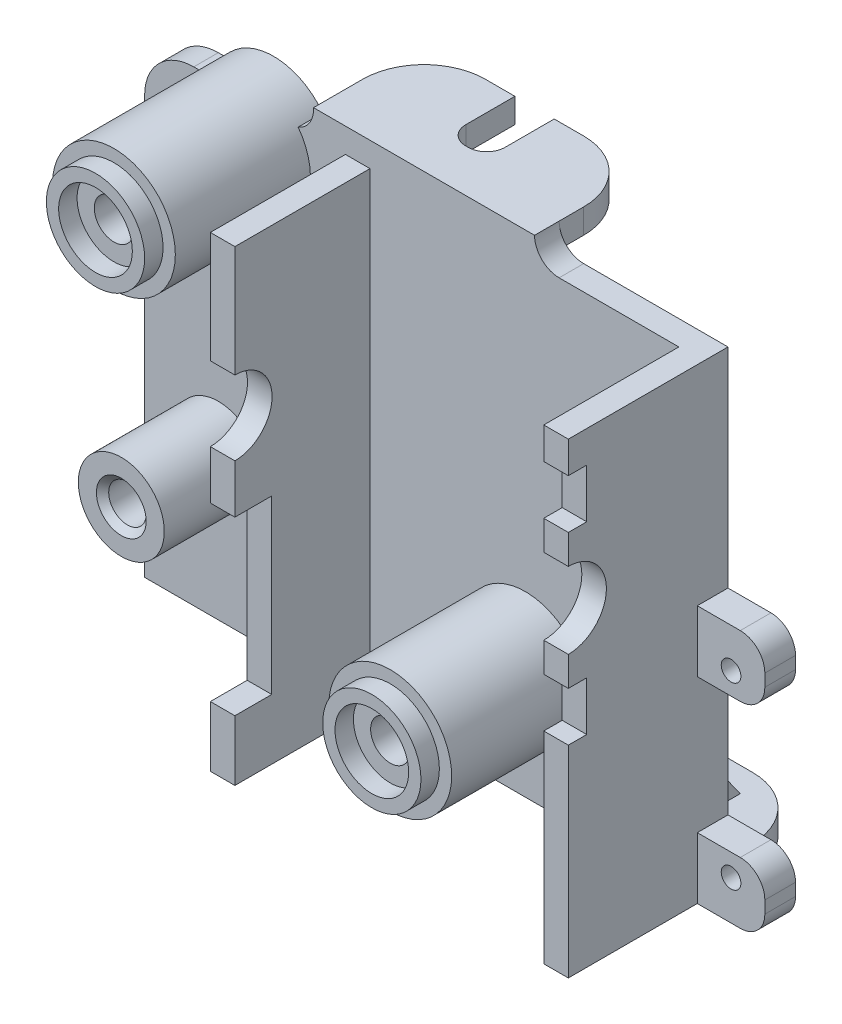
SolidWorks part; units mm, degrees
ref_plane "Face" through (0, 0, 0) normal (0, 0, 1) x (1, 0, 0)
ref_plane "Dessus" through (0, 0, 0) normal (0, 1, 0) x (1, 0, 0)
ref_plane "Droite" through (0, 0, 0) normal (1, 0, 0) x (0, 0, -1)
sketch "Esquisse1" plane through (0, 0, 0) normal (0, 0, 1) x (1, 0, 0)
  line L0 (-18.636, 0) -> (40.6725, 0) construction
  line L1 (0, 13.4516) -> (0, -31.9474) construction
  line L2 (-13.58, -13.58) -> (12.9107, -13.58) construction
  line L3 (11, 10.3689) -> (11, -7.2863) construction
  line L4 (12.35, 12.5556) -> (12.35, -11.4741) construction
  line L5 (37.5, 12.5556) -> (37.5, -10.7539) construction
  line L6 (-16.5535, -25.5) -> (42.4584, -25.5) construction
  line L7 (-16.0297, -27.5) -> (41.191, -27.5) construction
  line L8 (-6, 14.3889) -> (-6, -30.5277) construction
  line L9 (12.35, 10.45) -> (38.7737, 10.45) construction
  line L10 (11.7976, -10.45) -> (39.5594, -10.45) construction
  line L11 (39.5, 11.377) -> (39.5, -30.9205) construction
  line L12 (-10.1369, 12.5) -> (39.5, 12.5) construction
  line L14 (-6, 12.5) -> (39.5, 12.5)
  line L15 (-6, 12.5) -> (-6, -25.5)
  line L16 (-6, -25.5) -> (39.5, -25.5)
  line L17 (39.5, 12.5) -> (39.5, -25.5)
  circle A0 centre (0, -13.58) radius 11.5 construction
  circle A1 centre (0, -13.58) radius 1.5
extrude "Base-Extrusion" add sketch "Esquisse1" along normal mid plane 26
sketch "Esquisse5" plane through (0, 12.5, 0) normal (0, 1, 0) x (-1, 0, 0)
  line L0 (-12.35, -16.3279) -> (-12.35, 15.7701) construction
  line L1 (-10.35, -15.9222) -> (-10.35, 14.6545) construction
  line L2 (-37.5, -14.3503) -> (-37.5, 16.7842) construction
  line L3 (-39.5, -13.7925) -> (-39.5, 16.3786) construction
  line L4 (-40.8108, 11) -> (9.1448, 11) construction
  line L5 (-41.2165, -11) -> (8.3249, -11) construction
  line L7 (-37.5, 11) -> (-12.35, 11)
  line L8 (-37.5, 11) -> (-37.5, -11)
  line L9 (-37.5, -11) -> (-12.35, -11)
  line L10 (-12.35, 11) -> (-12.35, -11)
  line L11 (-10.35, 11) -> (8.7031, 11)
  line L12 (-10.35, 11) -> (-10.35, -11)
  line L13 (-10.35, -11) -> (8.7031, -11)
  line L14 (8.7031, 11) -> (8.7031, -11)
extrude "Enlèv. mat.-Extru.6" cut sketch "Esquisse5" against normal blind 40
sketch "Esquisse3" plane through (0, 0, 13) normal (0, 0, 1) x (1, 0, 0)
  circle A0 centre (0, -13.58) radius 3.5
extrude "Boss.-Extru.1" add sketch "Esquisse3" against normal blind 25
sketch "Esquisse4" plane through (0, 0, 13) normal (0, 0, 1) x (1, 0, 0)
  circle A0 centre (0, -13.58) radius 1.525
extrude "Enlèv. mat.-Extru.2" cut sketch "Esquisse4" against normal through all
sketch "Esquisse6" plane through (39.5, 0, 0) normal (1, 0, 0) x (0, 0, -1)
  line L0 (-13.8762, 0) -> (18.6073, 0) construction
  line L1 (0, 14.021) -> (0, -22.5589) construction
  circle A0 centre (0, 0.42) radius 3.025
extrude "Enlèv. mat.-Extru.3" cut sketch "Esquisse6" against normal through all
sketch "Esquisse7" plane through (39.5, 0, 0) normal (1, 0, 0) x (0, 0, -1)
  circle A0 centre (0, 0.42) radius 3.1
extrude "Enlèv. mat.-Extru.4" cut sketch "Esquisse7" against normal blind 3
sketch "Esquisse8" plane through (0, -25.5, 0) normal (0, -1, 0) x (1, 0, 0)
  line L0 (-6, 21.1962) -> (-6, -20.9902) construction
  line L1 (39.5, 20.4108) -> (39.5, -20.9902) construction
  line L2 (41.0671, -20) -> (-8.3785, -20) construction
  line L3 (-7.8207, 20) -> (40.3571, 20) construction
  line L5 (-6, 20) -> (39.5, 20)
  line L6 (-6, 20) -> (-6, 11.9399)
  line L7 (-6, 11.9399) -> (39.5, 11.9399)
  line L8 (39.5, 20) -> (39.5, 11.9399)
  line L9 (-6, -20) -> (39.5, -20)
  line L10 (-6, -20) -> (-6, -11.5095)
  line L11 (-6, -11.5095) -> (39.5, -11.5095)
  line L12 (39.5, -20) -> (39.5, -11.5095)
extrude "Boss.-Extru.2" add sketch "Esquisse8" against normal blind 2
sketch "Esquisse9" plane through (0, 12.5, 0) normal (0, 1, 0) x (-1, 0, 0)
  line L0 (6.6791, -3.1) -> (-6.4741, -3.1) construction
  line L1 (7.282, 3.1) -> (-7.5154, 3.1) construction
  line L3 (6.6791, -3.1) -> (-4.7203, -3.1)
  line L4 (6.6791, -3.1) -> (6.6791, 3.1)
  line L5 (6.6791, 3.1) -> (-4.7203, 3.1)
  line L6 (-4.7203, -3.1) -> (-4.7203, 3.1)
extrude "Enlèv. mat.-Extru.5" cut sketch "Esquisse9" against normal blind 32
sketch "Esquisse12" plane through (0, 0, 0) normal (0, 0, 1) x (1, 0, 0)
  line L0 (-4.6513, 9.5) -> (15.1881, 9.5) construction
  line L1 (18.2023, -16) -> (33.4929, -16) construction
  line L2 (25, -8.6922) -> (25, -25.0789) construction
  line L3 (2.5, 14.9287) -> (2.5, -0.5811) construction
  circle A0 centre (2.5, 9.5) radius 5
  circle A1 centre (25, -16) radius 5
extrude "Boss.-Extru.3" add sketch "Esquisse12" along normal mid plane 26
sketch "Esquisse13" plane through (0, 0, 0) normal (0, 0, 1) x (1, 0, 0)
  circle A0 centre (2.5, 9.5) radius 1.6
  circle A1 centre (25, -16) radius 1.6
extrude "Enlèv. mat.-Extru.8" cut sketch "Esquisse13" against normal mid plane 32
sketch "Esquisse14" plane through (0, -23.5, 0) normal (0, 1, 0) x (-1, 0, 0)
  line L0 (8.0853, 0) -> (-43.1429, 0) construction
  line L1 (-4, -22.6142) -> (-4, -6.692) construction
  line L2 (-39.5, -22.6142) -> (-39.5, -10.961) construction
  line L3 (-16.75, -22.0374) -> (-16.75, -8.8265) construction
  line L4 (-7.2, -22.0374) -> (-7.2, -8.8265) construction
  line L5 (2.9509, -14.5) -> (-11.9906, -14.5) construction
  line L6 (-26.3, -21.5758) -> (-26.3, -16)
  line L7 (-4, -21.5758) -> (-7.2, -21.5758)
  line L8 (-4, -21.5758) -> (-4, -16)
  line L9 (-5.5, -14.5) -> (-5.7, -14.5)
  line L10 (-7.2, -21.5758) -> (-7.2, -16)
  line L11 (-28, -14.5) -> (-27.8, -14.5)
  line L12 (-29.5, -21.5758) -> (-29.5, -16)
  line L13 (-29.5, -21.5758) -> (-26.3, -21.5758)
  line L14 (-29.5, 21.5758) -> (-26.3, 21.5758)
  line L15 (-29.5, 21.5758) -> (-29.5, 16)
  line L16 (-28, 14.5) -> (-27.8, 14.5)
  line L17 (-7.2, 21.5758) -> (-7.2, 16)
  line L18 (-5.5, 14.5) -> (-5.7, 14.5)
  line L19 (-4, 21.5758) -> (-4, 16)
  line L20 (-4, 21.5758) -> (-7.2, 21.5758)
  line L21 (-26.3, 21.5758) -> (-26.3, 16)
  arc A0 (-5.5, -14.5) -> (-4, -16) centre (-5.5, -16) cw
  arc A1 (-7.2, -16) -> (-5.7, -14.5) centre (-5.7, -16) cw
  arc A2 (-26.3, -16) -> (-27.8, -14.5) centre (-27.8, -16) ccw
  arc A3 (-28, -14.5) -> (-29.5, -16) centre (-28, -16) ccw
  arc A4 (-28, 14.5) -> (-29.5, 16) centre (-28, 16) cw
  arc A5 (-26.3, 16) -> (-27.8, 14.5) centre (-27.8, 16) cw
  arc A6 (-7.2, 16) -> (-5.7, 14.5) centre (-5.7, 16) ccw
  arc A7 (-5.5, 14.5) -> (-4, 16) centre (-5.5, 16) ccw
  dimension "D1" = 1.5
extrude "Enlèv. mat.-Extru.9" cut sketch "Esquisse14" against normal through all
sketch "Esquisse15" plane through (39.5, 0, 0) normal (1, 0, 0) x (0, 0, -1)
  line L0 (-1.5, 10.2278) -> (-1.5, -10.1958) construction
  line L1 (1.5, 10.3335) -> (1.5, -9.7969) construction
  line L2 (-3.0488, 7.5) -> (3.8686, 7.5) construction
  line L3 (-5.6888, 0.42) -> (7.1769, 0.42) construction
  line L4 (-2.4473, 9.92) -> (3.3339, 9.92) construction
  line L5 (-2.4473, 5.92) -> (3.5389, 5.92) construction
  line L6 (-1.5, -5.08) -> (-1.5, -9.08)
  line L7 (1.5, 5.92) -> (-1.5, 5.92)
  line L8 (1.5, 5.92) -> (1.5, 9.92)
  line L9 (1.5, 9.92) -> (-1.5, 9.92)
  line L10 (-1.5, 5.92) -> (-1.5, 9.92)
  line L11 (1.5, -9.08) -> (-1.5, -9.08)
  line L12 (1.5, -5.08) -> (1.5, -9.08)
  line L13 (1.5, -5.08) -> (-1.5, -5.08)
extrude "Enlèv. mat.-Extru.10" cut sketch "Esquisse15" against normal blind 3
fillet "Congé1" radius 5
fillet "Congé2" radius 4
chamfer "Chanfrein1" distance 0.5 angle 45
sketch "Esquisse16" plane through (0, 0, 0) normal (0, 0, 1) x (1, 0, 0)
  line L1 (-8.6726, 15.1395) -> (41.8545, 15.1395)
  line L2 (-8.6726, 15.1395) -> (-8.6726, -26.8516)
  line L3 (-8.6726, -26.8516) -> (41.8545, -26.8516)
  line L4 (41.8545, 15.1395) -> (41.8545, -26.8516)
extrude "Enlèv. mat.-Extru.12" cut sketch "Esquisse16" along normal blind 30
sketch "Esquisse17" plane through (0, 0, -13) normal (0, 0, -1) x (-1, 0, 0)
  line L0 (-30, -16) -> (-20.199, -16) construction
  line L1 (-25, -12.486) -> (-25, -20.8861) construction
  line L2 (-5.8684, 9) -> (2.1204, 9) construction
  line L3 (-2.5, 11.6857) -> (-2.5, 5.583) construction
  circle A0 centre (-25.0995, -16) radius 3.2
  circle A1 centre (-2.5, 9.5) radius 3.2
extrude "Enlèv. mat.-Extru.13" cut sketch "Esquisse17" against normal blind 11
sketch "Esquisse18" plane through (0, 0, 0) normal (0, 0, 1) x (1, 0, 0)
  line L0 (-4.1858, 9) -> (10.7968, 9) construction
  line L1 (2.5, 16.0119) -> (2.5, 3.4768) construction
  line L2 (18.8293, -16) -> (34.2125, -16) construction
  line L3 (25, -8.6554) -> (25, -23.4671) construction
  circle A0 centre (2.5, 9.5) radius 3
  circle A1 centre (25, -16) radius 3
  circle A2 centre (25, -16) radius 4
  circle A3 centre (2.5, 9.5) radius 4
extrude "Boss.-Extru.4" add sketch "Esquisse18" along normal blind 1.5
sketch "Esquisse20" plane through (0, 0, 0) normal (0, 0, 1) x (1, 0, 0)
  line L0 (0, -13.58) -> (19.4244, -13.58) construction
  line L1 (9.2982, -20.58) -> (14.8027, -20.58) construction
  line L2 (7.8441, -6.58) -> (16.1009, -6.58) construction
  line L4 (9.2982, -6.58) -> (13.4525, -6.58)
  line L5 (9.2982, -6.58) -> (9.2982, -20.58)
  line L6 (9.2982, -20.58) -> (13.4525, -20.58)
  line L7 (13.4525, -6.58) -> (13.4525, -20.58)
extrude "Enlèv. mat.-Extru.14" cut sketch "Esquisse20" against normal blind 3
sketch "Esquisse21" plane through (0, -23.5, 0) normal (0, 1, 0) x (-1, 0, 0)
  line L0 (-35.5, -10.467) -> (-35.5, -23.2453) construction
  line L1 (2, -12) -> (2, -22.8397) construction
  line L2 (0, -21.3691) -> (0, -12) construction
  line L3 (-33.5, -22.0283) -> (-33.5, -10.8219) construction
  line L4 (4.4712, -13) -> (-40.5065, -13) construction
  line L5 (4.0148, -18) -> (-41.0136, -18) construction
  line L7 (2, -18) -> (0, -18)
  line L8 (2, -18) -> (2, -12.6474)
  line L9 (2, -12.6474) -> (0, -12.6474)
  line L10 (0, -18) -> (0, -12.6474)
  line L11 (-33.5, -18) -> (-35.5, -18)
  line L12 (-33.5, -18) -> (-33.5, -12.6474)
  line L13 (-33.5, -12.6474) -> (-35.5, -12.6474)
  line L14 (-35.5, -18) -> (-35.5, -12.6474)
extrude "Boss.-Extru.5" add sketch "Esquisse21" along normal blind 7
chamfer "Chanfrein2" distance 7 distance2 5
sketch "Esquisse22" plane through (0, 12.5, 0) normal (0, 1, 0) x (-1, 0, 0)
  line L0 (-30.0056, -13) -> (9.2362, -13) construction
  line L1 (-30.9899, -20) -> (-6.2505, -20) construction
  line L2 (0, -11.4483) -> (0, 11.4536) construction
  line L3 (-16.75, -24.3758) -> (-16.75, -1.3426) construction
  line L4 (-25.75, -21.7509) -> (-25.75, -7.8391) construction
  line L5 (-16.65, -14.5) -> (-16.85, -14.5)
  line L6 (-27.512, -11) -> (-7.563, -11) construction
  line L7 (-18.35, -16) -> (-18.35, -20)
  line L8 (-18.35, -20) -> (-25.75, -20)
  line L9 (-25.75, -20) -> (-25.75, -11)
  line L10 (-18.35, -21.1603) -> (-18.35, -14.0154) construction
  line L11 (-28, -14.5) -> (-14.5154, -14.5) construction
  line L12 (-25.75, -11) -> (-7.75, -11)
  line L13 (-7.75, -20) -> (-7.75, -11)
  line L14 (-15.15, -20) -> (-7.75, -20)
  line L15 (-15.15, -16) -> (-15.15, -20)
  arc A0 (-18.35, -16) -> (-16.85, -14.5) centre (-16.85, -16) cw
  arc A1 (-15.15, -16) -> (-16.65, -14.5) centre (-16.65, -16) ccw
  point P17 (-16.75, -13)
  point P18 (-16.75, -20)
  point P26 (-16.75, -14.5)
  point P31 (-16.75, -11)
  point P33 (-16.75, -14.5)
  dimension "D1" = 1.5
extrude "Boss.-Extru.6" add sketch "Esquisse22" along normal blind 2
fillet "Congé3" radius 2
fillet "Congé4" radius 5
sketch "Esquisse23" plane through (0, 0, -13) normal (0, 0, -1) x (-1, 0, 0)
  text T0 "www.a4.fr" font "Arial" height 3.5
  point P1 (0, 0)
extrude "Boss.-Extru.7" add sketch "Esquisse23" along normal blind 0.3
sketch "Esquisse25" plane through (0, 0, -13) normal (0, 0, -1) x (-1, 0, 0)
  line L0 (-36.9245, -20.5) -> (-51.2569, -20.5) construction
  line L1 (-35.9898, -25.5) -> (-53.9573, -25.5) construction
  line L2 (-47.3622, -9.5) -> (-9.5, -9.5) construction
  line L3 (-47.3622, -4.5) -> (-36.9245, -4.5) construction
  line L4 (-39.469, 2.4971) -> (-39.469, -30.2183) construction
  line L5 (-45, 0.9911) -> (-45, -27.7776) construction
  line L6 (-42.25, -2.9035) -> (-42.25, -27.0506) construction
  line L7 (-43.5195, -7.7) -> (-41.3385, -7.7) construction
  line L8 (-42.9483, -22.3) -> (-41.3385, -22.3) construction
  line L10 (-45, -4.5) -> (-39.0536, -4.5)
  line L11 (-45, -4.5) -> (-45, -9.5)
  line L12 (-45, -9.5) -> (-39.0536, -9.5)
  line L13 (-39.0536, -4.5) -> (-39.0536, -9.5)
  line L14 (-45, -20.5) -> (-39.1574, -20.5)
  line L15 (-45, -20.5) -> (-45, -25.5)
  line L16 (-45, -25.5) -> (-39.1574, -25.5)
  line L17 (-39.1574, -20.5) -> (-39.1574, -25.5)
  circle A0 centre (-42.25, -7.7) radius 0.8
  circle A1 centre (-42.25, -22.3) radius 0.8
extrude "Boss.-Extru.8" add sketch "Esquisse25" against normal blind 2.5
fillet "Congé5" radius 2
